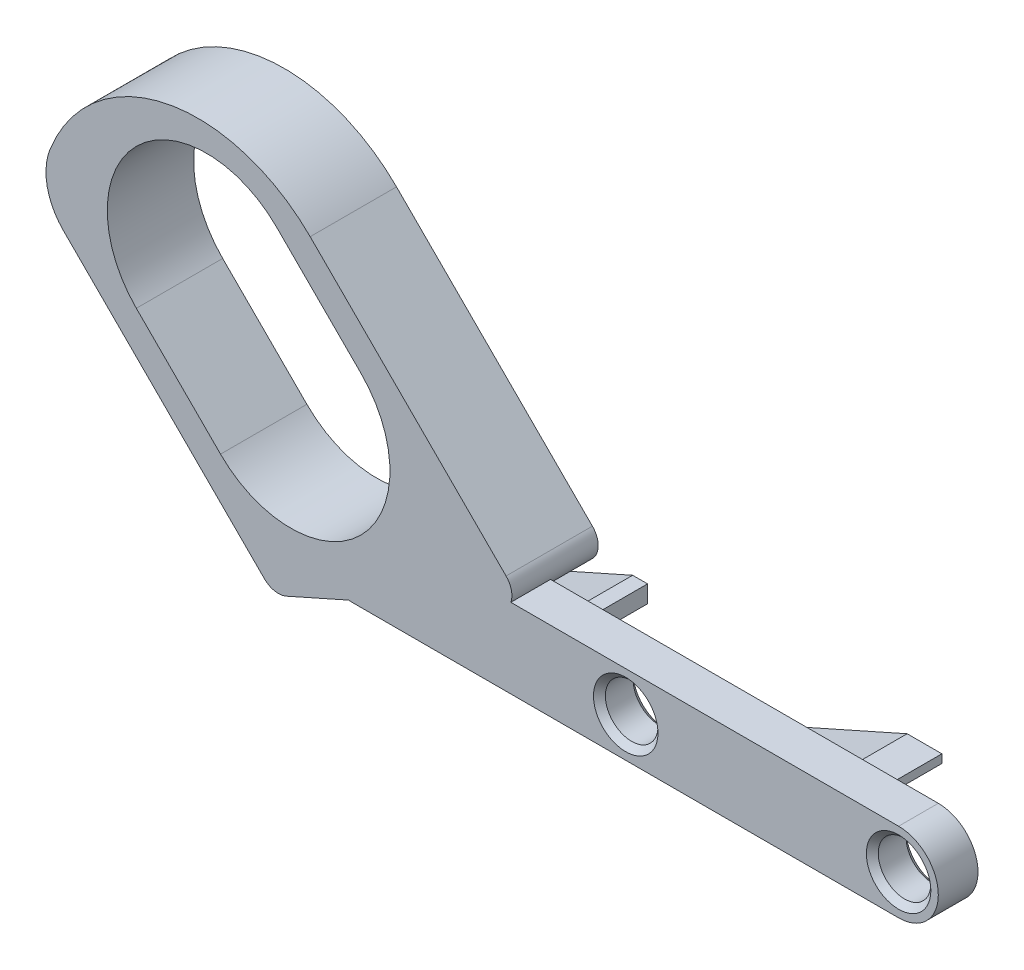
SolidWorks part; units mm, degrees
ref_plane "Alzado" through (0, 0, 0) normal (0, 0, 1) x (1, 0, 0)
ref_plane "Planta" through (0, 0, 0) normal (0, 1, 0) x (1, 0, 0)
ref_plane "Vista lateral" through (0, 0, 0) normal (1, 0, 0) x (0, 0, -1)
sketch "Sketch1" plane through (0, 0, 0) normal (0, 0, 1) x (1, 0, 0)
  line L0 (-27.5, 0) -> (27.5, 0) construction
  line L1 (-27.5, 4) -> (27.5, 4)
  line L2 (-27.5, -4) -> (27.5, -4)
  arc A0 (-27.5, 4) -> (-27.5, -4) centre (-27.5, 0) ccw
  arc A1 (27.5, -4) -> (27.5, 4) centre (27.5, 0) ccw
  point P3 (0, 0)
extrude "Boss-Extrude1" add sketch "Sketch1" along normal blind 4
sketch "Sketch2" plane through (0, 0, 4) normal (0, 0, 1) x (1, 0, 0)
  circle A1 centre (0, 0) radius 2.65
  circle A2 centre (27.5, 0) radius 2.65
extrude "Cut-Extrude1" cut sketch "Sketch2" against normal through all
chamfer "Chamfer4" distance 0.6 angle 45 1 edges at (2.65, 0, 0)
chamfer "Chamfer5" distance 0.6 angle 45 1 edges at (2.65, 0, 4)
chamfer "Chamfer6" distance 0.6 angle 45 1 edges at (30.15, 0, 0)
chamfer "Chamfer7" distance 0.6 angle 45 1 edges at (30.15, 0, 4)
sketch "Sketch5" plane through (0, 0, 0) normal (0, 0, -1) x (-1, 0, 0)
  line L0 (-23.161, 3.8) -> (-23.161, 2.9501)
  line L1 (-23.161, 2.9501) -> (-8, -3.8)
  line L2 (-8, -3.8) -> (-6.5, -3.8)
  line L3 (-6.5, -3.8) -> (-6.5, -2.0596)
  line L4 (-6.5, -2.0596) -> (-19.661, 3.8)
  line L5 (-19.661, 3.8) -> (-23.161, 3.8)
  line L6 (27.5, -4) -> (-27.5, -4) construction
  line L7 (-27.5, 4) -> (27.5, 4) construction
  dimension "D1" = 156
  dimension "D2" = 0.2
  dimension "D3" = 0.2
  dimension "D4" = 2.2
  dimension "D5" = 6.5
  dimension "D6" = 1.5
  dimension "D7" = 3.5
extrude "Boss-Extrude2" add sketch "Sketch5" along normal blind 4.7
mirror "Mirror1" about plane through (0, 0, 0) normal (0, 1, 0) of "Boss-Extrude2"
sketch "Sketch6" plane through (0, 0, -4.7) normal (0, 0, -1) x (-1, 0, 0)
  line L0 (-15.1048, 1.7714) -> (-8.7515, -1.0572)
  line L1 (-13.8305, 1.2041) -> (-19.661, 3.8) construction
  line L2 (-6.5, -2.0596) -> (-11.126, 0) construction
  line L3 (-8.7515, -1.0572) -> (-4.1103, 2.5131)
  line L4 (-4.1103, 2.5131) -> (-7.2468, 7.6014)
  line L5 (-7.2468, 7.6014) -> (-15.1048, 1.7714)
  line L6 (-17.6266, 0.4861) -> (-11.7196, -2.1439)
  line L7 (-23.161, 2.9501) -> (-16.5349, 0) construction
  line L8 (-13.8305, -1.2041) -> (-8, -3.8) construction
  line L9 (-11.7196, -2.1439) -> (-16.6489, -6.3188)
  line L10 (-16.6489, -6.3188) -> (-25.7645, -5.2342)
  line L11 (-25.7645, -5.2342) -> (-21.9821, -0.1889)
  line L12 (-21.9821, -0.1889) -> (-17.6266, 0.4861)
  line L13 (8.5842, 1.1317) -> (14.7037, -1.5929)
  line L14 (6.5, 2.0596) -> (11.126, 0) construction
  line L15 (13.8305, -1.2041) -> (19.661, -3.8) construction
  line L16 (14.7037, -1.5929) -> (6.4424, -5.613)
  line L17 (6.4424, -5.613) -> (4.5258, -0.3828)
  line L18 (4.5258, -0.3828) -> (8.5842, 1.1317)
  line L19 (11.9832, 2.0266) -> (17.7586, -0.5448)
  line L20 (13.8305, 1.2041) -> (8, 3.8) construction
  line L21 (23.161, -2.9501) -> (16.5349, 0) construction
  line L22 (17.7586, -0.5448) -> (24.258, 3.4369)
  line L23 (24.258, 3.4369) -> (16.814, 7.9124)
  line L24 (16.814, 7.9124) -> (11.9832, 2.0266)
extrude "Cut-Extrude2" cut sketch "Sketch6" against normal up to surface (4.7 mm away)
sketch "Sketch8" plane through (0, 0, 0) normal (0, 0, 1) x (1, 0, 0)
  line L1 (-12.0577, 6.0577) -> (-31.7992, 25.7992)
  line L2 (-36.414, -6.3556) -> (-56.6647, 13.8952)
  line L6 (-6.573, 0) -> (7.3222, 0) construction
  line L7 (-12.6584, 2.8164) -> (-34.1863, -6.7684)
  line L8 (27.5, 4) -> (-27.5, 4) construction
  line L9 (-33.761, 9.3762) -> (-42.2463, 17.8615) construction
  line L10 (-40.8321, 2.3051) -> (-49.3173, 10.7904)
  line L11 (-26.6899, 16.4473) -> (-35.1752, 24.9326)
  arc A4 (-31.7992, 25.7992) -> (-58.0076, 20.3292) centre (-43.1129, 14.4855) ccw
  arc A5 (-12.0577, 6.0577) -> (-12.6584, 2.8164) centre (-13.4719, 4.6435) cw
  arc A6 (-40.8321, 2.3051) -> (-26.6899, 16.4473) centre (-33.761, 9.3762) ccw
  arc A7 (-35.1752, 24.9326) -> (-49.3173, 10.7904) centre (-42.2463, 17.8615) ccw
  arc A8 (-36.414, -6.3556) -> (-34.1863, -6.7684) centre (-34.9998, -4.9413) ccw
  arc A9 (-58.0076, 20.3292) -> (-56.6647, 13.8952) centre (-52.4221, 18.1378) ccw
  point P2 (-38.0036, 13.6188)
  point P24 (-10, 4)
  dimension "D8" = 3
  dimension "D6" = 2
  dimension "D9" = 16
  dimension "D1" = 2
  dimension "D4" = 6
  dimension "D2" = 20
  dimension "D3" = 12
  dimension "D5" = 24
  dimension "D7" = 10
  dimension "D10" = 3
extrude "Boss-Extrude3" add sketch "Sketch8" against normal up to surface and the other way up to surface
sketch "Sketch10" plane through (0, 0, -4.7) normal (0, 0, -1) x (-1, 0, 0)
  circle A0 centre (33.761, 9.3762) radius 10
  arc A1 (26.6899, 16.4473) -> (40.8321, 2.3051) centre (33.761, 9.3762) ccw construction
extrude "Cut-Extrude3" cut sketch "Sketch10" against normal up to surface (8.7 mm away)
equation "\"largo\"= 55"
equation "\"ancho\"= 8"
equation "\"thick_c\"= 1.5"
equation "\"c\"= 5.3"
equation "\"chan_1\"= 0.6"
equation "\"D1@Sketch1\"=\"largo\""
equation "\"D1@Boss-Extrude1\"=\"thick\""
equation "\"D2@Sketch2\"=\"largo\"/2"
equation "\"thick\"= 4"
equation "\"D4@Sketch2\"=\"c\""
equation "\"D5@Sketch2\"=\"c\""
equation "\"D1@Chamfer4\"=\"chan_1\""
equation "\"D1@Chamfer5\"=\"chan_1\""
equation "\"D1@Chamfer6\"=\"chan_1\""
equation "\"D1@Chamfer7\"=\"chan_1\""
equation "\"D2@Sketch1\"=\"ancho\""
